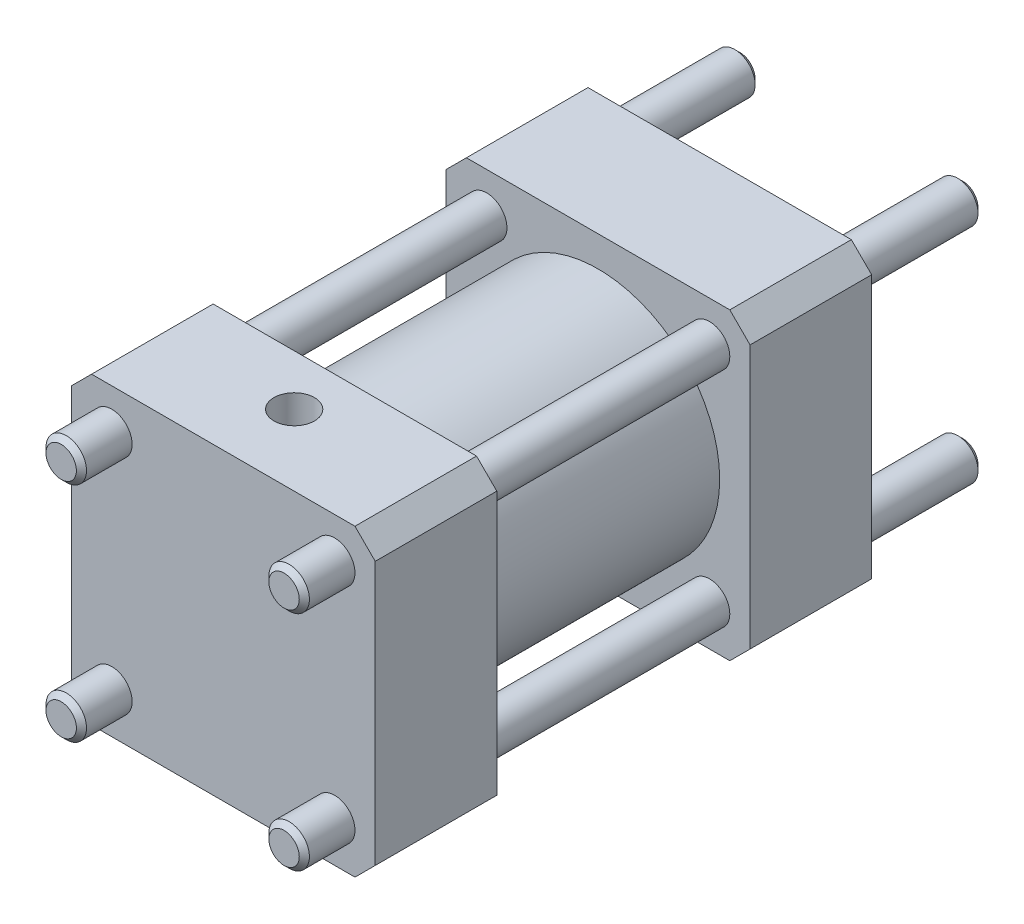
SolidWorks part; units mm, degrees
ref_plane "Plane1" through (0, 0, 0) normal (0, 0, 1) x (1, 0, 0)
ref_plane "Plane2" through (0, 0, 0) normal (0, 1, 0) x (1, 0, 0)
ref_plane "Plane3" through (0, 0, 0) normal (1, 0, 0) x (0, 0, -1)
sketch "Esquisse1" plane through (0, 0, 0) normal (0, 0, 1) x (1, 0, 0)
  line L0 (0, 30) -> (30, 30)
  line L1 (0, 30) -> (0, 0)
  line L2 (30, 0) -> (0, 0)
  line L3 (30, 0) -> (30, 30)
  dimension "D1" = 30
  dimension "D2" = 30
extrude "Base-Extrusion" add sketch "Esquisse1" along normal blind 12
sketch "Esquisse2" plane through (0, 0, 12) normal (0, 0, 1) x (1, 0, 0)
  line L0 (15, 0) -> (15, 34.1757) construction
  line L2 (30, 0) -> (30, 30) construction
  line L6 (30, 0) -> (0, 0) construction
  circle A0 centre (15, 15) radius 10
  dimension "D1" = 20
  dimension "D3" = 15
  dimension "D2" = 15
extrude "Bos.-Extru.-Mince1" add sketch "Esquisse2" along normal blind 25 thin
sketch "Esquisse3" plane through (0, 0, 37) normal (0, 0, 1) x (1, 0, 0)
  line L0 (0, 30) -> (30, 30)
  line L1 (0, 30) -> (0, 0)
  line L2 (30, 0) -> (0, 0)
  line L3 (30, 0) -> (30, 30)
  line L5 (30, 0) -> (30, 30) construction
  line L6 (0, 30) -> (30, 30) construction
  line L7 (30, 0) -> (0, 0) construction
  line L8 (0, 30) -> (0, 0) construction
extrude "Boss.-Extru.1" add sketch "Esquisse3" along normal blind 12
sketch "Esquisse4" plane through (0, 0, 12) normal (0, 0, 1) x (1, 0, 0)
  line L0 (0, 30) -> (0, 0) construction
  line L1 (0, 30) -> (30, 30) construction
  circle A0 centre (4, 26) radius 2
  dimension "D1" = 4
  dimension "D2" = 4
  dimension "D3" = 4
extrude "Boss.-Extru.2" add sketch "Esquisse4" along normal up to next
sketch "Esquisse5" plane through (19.9168, 0.8801, 12) normal (0, 0, 1) x (1, 0, 0)
  line L0 (-19.9168, 29.1199) -> (10.0832, 29.1199) construction
  line L1 (10.0832, -0.8801) -> (10.0832, 29.1199) construction
  circle A0 centre (6.0832, 25.1199) radius 2
  dimension "D2" = 4
  dimension "D1" = 4
  dimension "D3" = 4
extrude "Boss.-Extru.3" add sketch "Esquisse5" along normal up to next
sketch "Esquisse6" plane through (19.4268, -16.989, 12) normal (0, 0, 1) x (1, 0, 0)
  line L0 (10.5732, 16.989) -> (10.5732, 46.989) construction
  line L1 (10.5732, 16.989) -> (-19.4268, 16.989) construction
  circle A0 centre (6.5732, 20.989) radius 2
  dimension "D1" = 4
  dimension "D2" = 4
  dimension "D3" = 4
extrude "Boss.-Extru.4" add sketch "Esquisse6" along normal up to next
sketch "Esquisse7" plane through (0.7318, -18.4301, 12) normal (0, 0, 1) x (1, 0, 0)
  line L0 (-0.7318, 48.4301) -> (-0.7318, 18.4301) construction
  line L1 (29.2682, 18.4301) -> (-0.7318, 18.4301) construction
  circle A0 centre (3.2682, 22.4301) radius 2
  dimension "D1" = 4
  dimension "D2" = 4
  dimension "D3" = 4
extrude "Boss.-Extru.5" add sketch "Esquisse7" along normal up to next
sketch "Esquisse10" plane through (0, 0, 0) normal (0, 0, -1) x (-1, 0, 0)
  line L2 (0, 30) -> (0, 0) construction
  line L3 (-30, 0) -> (0, 0) construction
  circle A0 centre (-15, 15) radius 9
  dimension "D1" = 18
  dimension "D2" = 15
  dimension "D3" = 15
extrude "Boss.-Extru.6" add sketch "Esquisse10" along normal blind 6
sketch "Esquisse15" plane through (0, 0, 0) normal (0, 0, -1) x (-1, 0, 0)
  circle A0 centre (-4, 26) radius 2 construction
  circle A1 centre (-4, 26) radius 2
  circle A2 centre (-4, 4) radius 2 construction
  circle A3 centre (-4, 4) radius 2
  circle A4 centre (-26, 4) radius 2 construction
  circle A5 centre (-26, 4) radius 2
  circle A6 centre (-26, 26) radius 2 construction
  circle A7 centre (-26, 26) radius 2
extrude "Extrusion1" add sketch "Esquisse15" along normal blind 13
sketch "Esquisse16" plane through (0, 0, 49) normal (0, 0, 1) x (1, 0, 0)
  circle A0 centre (26, 26) radius 2 construction
  circle A1 centre (26, 26) radius 2
  circle A2 centre (26, 4) radius 2 construction
  circle A3 centre (26, 4) radius 2
  circle A4 centre (4, 4) radius 2 construction
  circle A5 centre (4, 4) radius 2
  circle A6 centre (4, 26) radius 2 construction
  circle A7 centre (4, 26) radius 2
extrude "Extrusion2" add sketch "Esquisse16" along normal blind 5
chamfer "Chanfrein2" distance 0.5 angle 45 8 edges at (28, 26, 54) (28, 4, 54) (6, 26, 54) (6, 4, 54) (2, 4, -13) (24, 4, -13) (2, 26, -13) (24, 26, -13)
ref_plane "Plan1" through (30, 30, 0) normal (0, 1, 0) x (-1, 0, 0)
chamfer "Chanfrein5" distance 1 angle 45 1 edges at (6, 15, -6)
sketch "Esquisse17" plane through (0, 0, -6) normal (0, 0, -1) x (-1, 0, 0)
  circle A0 centre (-15, 15) radius 4
  dimension "D1" = 8
extrude "Enlèv. mat.-Extru.1" cut sketch "Esquisse17" against normal blind 26.6705
chamfer "Chanfrein6" distance 2 angle 45 8 edges at (30, 0, 43) (30, 0, 6) (0, 0, 6) (0, 0, 43) (0, 30, 43) (30, 30, 43) (30, 30, 6) (0, 30, 6)
ref_plane "Plan2" through (0, 0, 24.5) normal (0, 0, 1) x (1, 0, 0)
sketch "Esquisse24" plane through (0, 0, 12) normal (0, 0, 1) x (1, 0, 0)
  circle A0 centre (15, 15) radius 7.5
  circle A1 centre (15, 15) radius 6.5
  dimension "D1" = 15
  dimension "D2" = 13
extrude "Enlèv. mat.-Extru.2" cut sketch "Esquisse24" against normal blind 8
sketch "Esquisse25" plane through (0, 0, 12) normal (0, 0, 1) x (1, 0, 0)
  circle A0 centre (15, 15) radius 6.5
  circle A1 centre (15, 15) radius 6.5 construction
extrude "Enlèv. mat.-Extru.3" cut sketch "Esquisse25" against normal blind 4
chamfer "Chanfrein7" distance 1 angle 45 1 edges at (21.5, 15, 8)
hole_wizard "Diamètre du perçage Ø4.0 (4)1" positions "Esquisse27" profile "Esquisse26" hole size "Ø4.0" standard "Ansi Métrique"
sketch "Esquisse27" plane through (0, 30, 0) normal (0, 1, 0) x (-1, 0, 0)
  line L0 (-2, 37) -> (-28, 37) construction
  line L1 (0, 49) -> (0, 37) construction
  point P0 (-15, 42)
  dimension "D1" = 5
  dimension "D2" = 15
sketch "Esquisse26" plane through (15, 30, 42) normal (1, 0, 0) x (0, 0, 1)
  line L0 (0, 0) -> (0, 18.2017)
  line L1 (0, 18.2017) -> (2, 17)
  line L2 (2, 17) -> (2, 0)
  line L5 (2, 0) -> (0, 0)
  line L10 (0, 18.2017) -> (-2, 17) construction
  line L11 (0, -6.35) -> (0, 107.95) construction
  dimension "Diamètre du perçage" = 4
  dimension "Profondeur du perçage" = 17
  dimension "Angle de pointe" = 118
sketch "Esquisse28" plane through (0, 0, 37) normal (0, 0, -1) x (-1, 0, 0)
  circle A0 centre (-15, 15) radius 2
  dimension "D1" = 4
extrude "Enlèv. mat.-Extru.4" cut sketch "Esquisse28" against normal blind 5
